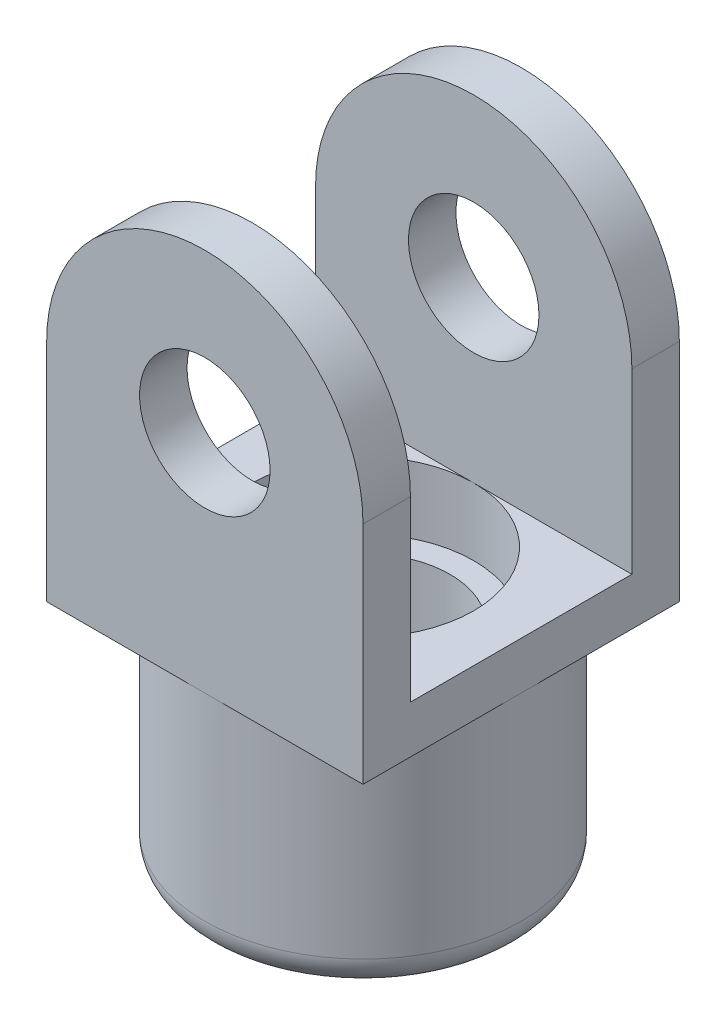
SolidWorks part; units mm, degrees
ref_plane "Front" through (0, 0, 0) normal (0, 0, 1) x (1, 0, 0)
ref_plane "Top" through (0, 0, 0) normal (0, 1, 0) x (1, 0, 0)
ref_plane "Right" through (0, 0, 0) normal (1, 0, 0) x (0, 0, -1)
sketch "Sketch1" plane through (0, 0, 0) normal (0, 0, 1) x (1, 0, 0)
  line L0 (-5.08, 0) -> (5.08, 0)
  line L1 (-5.08, 0) -> (-5.08, 7.239)
  line L3 (5.08, 7.239) -> (5.08, 0)
  arc A0 (-5.08, 7.239) -> (5.08, 7.239) centre (0, 7.239) cw
  dimension "D1" = 10.16
  dimension "D2" = 12.319
extrude "Base-Extrude" add sketch "Sketch1" along normal mid plane 10.16
shell "Shell1" thickness 1.524
sketch "Sketch2" plane through (0, 0, 5.08) normal (0, 0, 1) x (1, 0, 0)
  circle A0 centre (0, 7.239) radius 2.0955
  dimension "D1" = 4.191
extrude "Cut-Extrude1" cut sketch "Sketch2" against normal through all
sketch "Sketch4" plane through (0, 0, 0) normal (0, -1, 0) x (1, 0, 0)
  line L3 (5.08, 5.08) -> (5.08, -5.08) construction
  circle A0 centre (0, 0) radius 5.08
extrude "Boss-Extrude1" add sketch "Sketch4" along normal blind 7.366
sketch "Sketch5" plane through (0, -7.366, 0) normal (0, -1, 0) x (1, 0, 0)
  circle A0 centre (0, 0) radius 2.794
  dimension "D1" = 5.588
extrude "Cut-Extrude2" cut sketch "Sketch5" against normal through all
sketch "Sketch3" plane through (0, 1.524, 0) normal (0, 1, 0) x (-1, 0, 0)
  line L0 (5.08, -3.556) -> (-5.08, -3.556) construction
  circle A0 centre (0, 0) radius 3.556
extrude "Cut-Extrude3" cut sketch "Sketch3" against normal blind 2.159
sketch "Sketch6" plane through (0, -7.366, 0) normal (0, -1, 0) x (1, 0, 0)
  circle A0 centre (0, 0) radius 3.937
  dimension "D1" = 7.874
extrude "Cut-Extrude4" cut sketch "Sketch6" against normal blind 2.159
fillet "Fillet1" radius 1.016 1 edges at (5.08, -7.366, 0)
